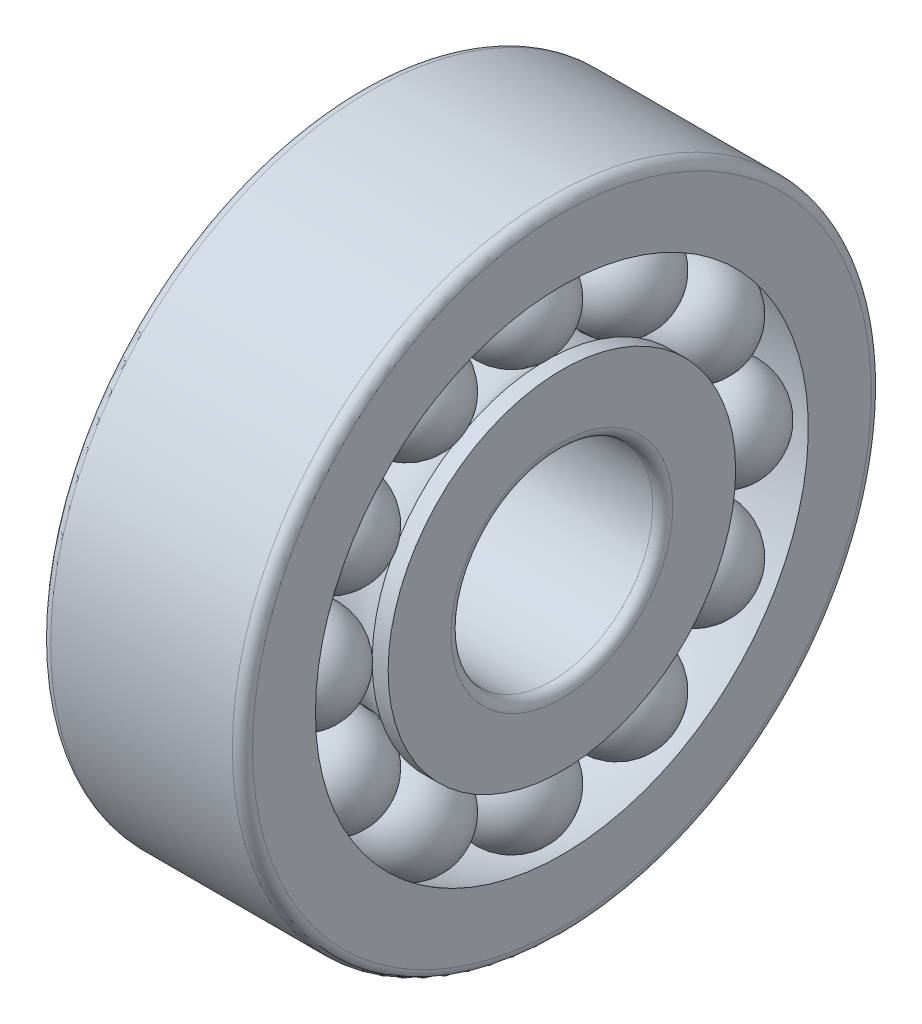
SolidWorks part; units mm, degrees
ref_plane "Front" through (0, 0, 0) normal (0, 0, 1) x (1, 0, 0)
ref_plane "Top" through (0, 0, 0) normal (0, 1, 0) x (1, 0, 0)
ref_plane "Right" through (0, 0, 0) normal (1, 0, 0) x (0, 0, -1)
other "Configuration Table"
sketch "Sketch1" plane through (0, 0, 0) normal (0, 0, 1) x (1, 0, 0)
  line L0 (0, 0) -> (10.4156, 0) construction
  line L1 (-3, 3) -> (3, 3)
  line L2 (3, 3) -> (3, 5.1667)
  line L3 (3, 5.1667) -> (2.523, 5.1667)
  line L4 (-3, 5.1667) -> (-3, 3)
  line L5 (-2.523, 5.1667) -> (-3, 5.1667)
  line L6 (0.477, 5.1667) -> (-0.477, 5.1667)
  circle A0 centre (-1.5, 6.25) radius 1.49 construction
  circle A1 centre (1.5, 6.25) radius 1.49 construction
  arc A2 (-2.523, 5.1667) -> (-0.477, 5.1667) centre (-1.5, 6.25) ccw
  arc A3 (0.477, 5.1667) -> (2.523, 5.1667) centre (1.5, 6.25) ccw
  point P8 (0, 3)
revolve "Revovle1" add sketch "Sketch1" angle 360 about L0
sketch "Sketch2" plane through (0, 0, 0) normal (0, 0, 1) x (1, 0, 0)
  line L0 (-2.9995, 6.25) -> (-0.0005, 6.25)
  line L1 (-4.0336, 6.25) -> (6.5093, 6.25) construction
  arc A2 (-2.9995, 6.25) -> (-0.0005, 6.25) centre (-1.5, 6.25) ccw
revolve "Revolve2" add sketch "Sketch2" angle 360 about L1
mirror "Mirror1" about plane through (0, 0, 0) normal (1, 0, 0) of "Revolve2"
sketch "Sketch3" plane through (0, 0, 0) normal (0, 0, 1) x (1, 0, 0)
  line L0 (-3, 7.3271) -> (-3, 9.5)
  line L1 (-3, 9.5) -> (3, 9.5)
  line L2 (3, 9.5) -> (3, 7.3271)
  line L5 (0, 0) -> (7.3928, 0) construction
  line L7 (3, -5.1667) -> (3, 5.1667) construction
  line L8 (-3, 5.1667) -> (-3, -5.1667) construction
  circle A0 centre (-1.5, 6.25) radius 1.49 construction
  circle A1 centre (1.5, 6.25) radius 1.49 construction
  arc A2 (3, 7.3271) -> (-3, 7.3271) centre (0, 0) ccw
revolve "Revolve3" add sketch "Sketch3" angle 360 about L5
pattern_circular "Circular-Pattern1" count 12 over 360 about axis through (0, 0, 0) along (1, 0, 0) of "Revolve2", "Mirror1"
fillet "Fillet1" radius 0.3 4 edges at (-3, 0, 3) (-3, 0, 9.5) (3, 0, 3) (3, 0, 9.5)
equation "\"XD1@Sketch1\" = \"XD@Sketch1\" +  ( \"DD@Sketch3\" - \"XD@Sketch1\" )  / 3"
equation "\"QDD@Sketch1\" = \"XD@Sketch1\" +  ( \"DD@Sketch3\" - \"XD@Sketch1\" )  / 2"
equation "\"QXD@Sketch1\" = \"DB@Sketch1\" / 2 - 0.02"
equation "\"D1@Sketch1\" = \"DB@Sketch1\" / 4"
equation "\"D2@Sketch1\" = \"D1@Sketch1\""
equation "\"QXD@Sketch2\" = \"DB@Sketch1\"/2-0.001"
equation "\"D2@Sketch2\" = \"D2@Sketch1\""
equation "\"D1@Sketch2\" = \"QDD@Sketch1\" / 2"
equation "\"D1@Sketch3\" = \"QDD@Sketch1\" / 2"
equation "\"D2@Sketch3\" = \"QXD@Sketch1\""
equation "\"D3@Sketch3\" = \"D2@Sketch1\""
equation "\"D4@Sketch3\" = \"D3@Sketch3\""
equation "\"D1@Circular-Pattern1\" = int( 3.14159265 / atn(( \"QXD@Sketch2\" / 2) / sqr(\"QDD@Sketch1\" *\"QDD@Sketch1\"/4 - ( \"QXD@Sketch2\" / 2) *  ( \"QXD@Sketch2\" / 2))))"
